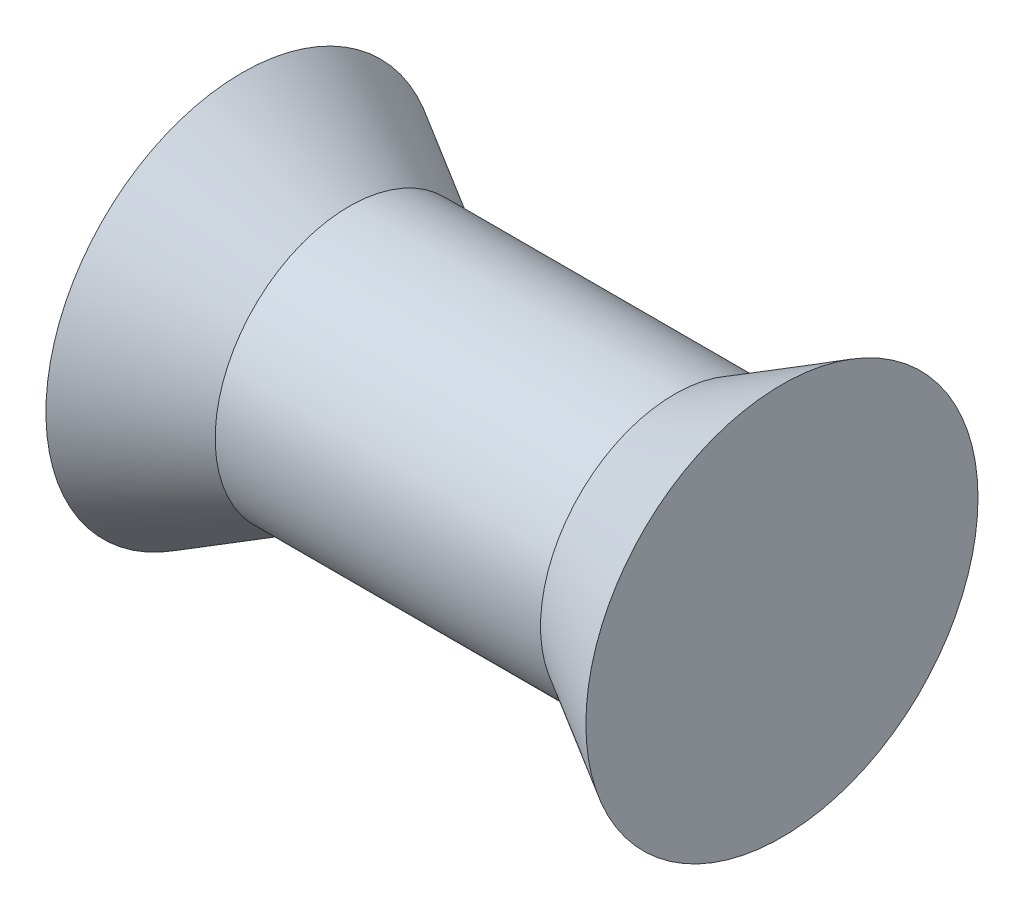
SolidWorks part; units mm, degrees
ref_plane "Спереди" through (0, 0, 0) normal (0, 0, 1) x (1, 0, 0)
ref_plane "Сверху" through (0, 0, 0) normal (0, 1, 0) x (1, 0, 0)
ref_plane "Справа" through (0, 0, 0) normal (1, 0, 0) x (0, 0, -1)
sketch "Эскиз1" plane through (0, 0, 0) normal (0, 0, 1) x (1, 0, 0)
  line L0 (0, 0) -> (-49.4301, 0) construction
  line L1 (0, 0) -> (0, 2.8777)
  line L2 (0, 2.8777) -> (-1.5748, 1.9685)
  line L3 (-1.5748, 1.9685) -> (-6.35, 1.9685)
  line L4 (-6.35, 1.9685) -> (-7.9248, 2.8777)
  line L6 (-8.6143, 0) -> (0, 0)
  arc A0 (-7.9248, 2.8777) -> (-8.6143, 0) centre (-2.2643, 0) ccw
  dimension "D6" = 6.35
  dimension "D1" = 30
  dimension "D2" = 30
  dimension "D3" = 3.937
  dimension "D4" = 1.5748
  dimension "D5" = 7.9248
revolve "Повернуть1" add sketch "Эскиз1" angle 360 about L0
